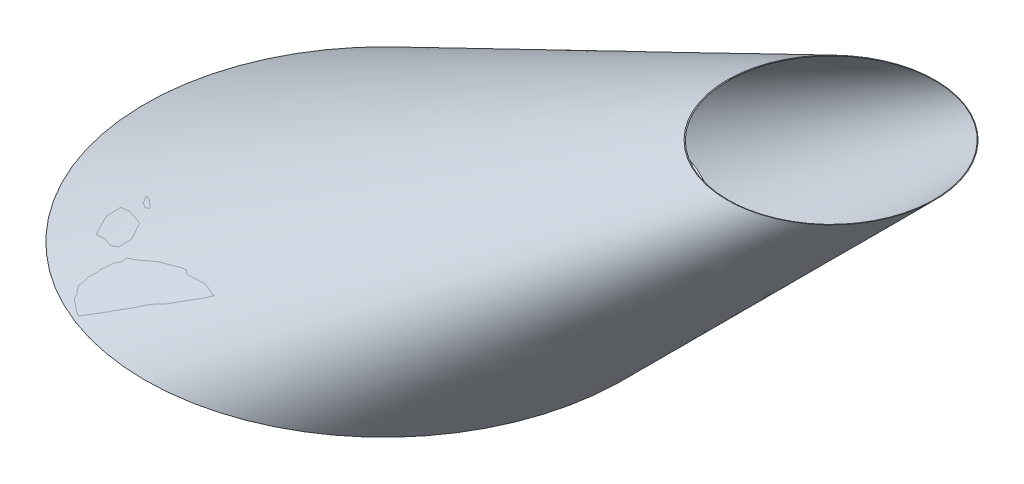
SolidWorks part; units mm, degrees
ref_plane "前视基准面" through (0, 0, 0) normal (0, 0, 1) x (1, 0, 0)
ref_plane "上视基准面" through (0, 0, 0) normal (0, 1, 0) x (1, 0, 0)
ref_plane "右视基准面" through (0, 0, 0) normal (1, 0, 0) x (0, 0, -1)
sketch "草图1" plane through (0, 0, 0) normal (0, 1, 0) x (1, 0, 0)
  line L0 (-460, 0) -> (460, 0) construction
  circle A0 centre (0, 0) radius 460
  dimension "D" = 920
sketch "草图2" plane through (0, 0, 0) normal (0, 0, 1) x (1, 0, 0)
  line L0 (-460, 0) -> (1521.5385, 1061.5385) construction
  line L1 (1521.5385, 1061.5385) -> (460, 0) construction
  line L2 (660, 600) -> (1060, 600)
  line L3 (-460, 0) -> (460, 0) construction
  dimension "d" = 400
  dimension "H0" = 600
  dimension "β" = 45
sketch "草图3" plane through (0, 0, 0) normal (0, 0, 1) x (1, 0, 0)
  point P0 (1521.5385, 1061.5385)
loft "放样1" add profiles "草图1", "草图3"
extrude "切除-拉伸1" cut sketch "草图2" against normal through all and the other way through all
shell "抽壳1"
